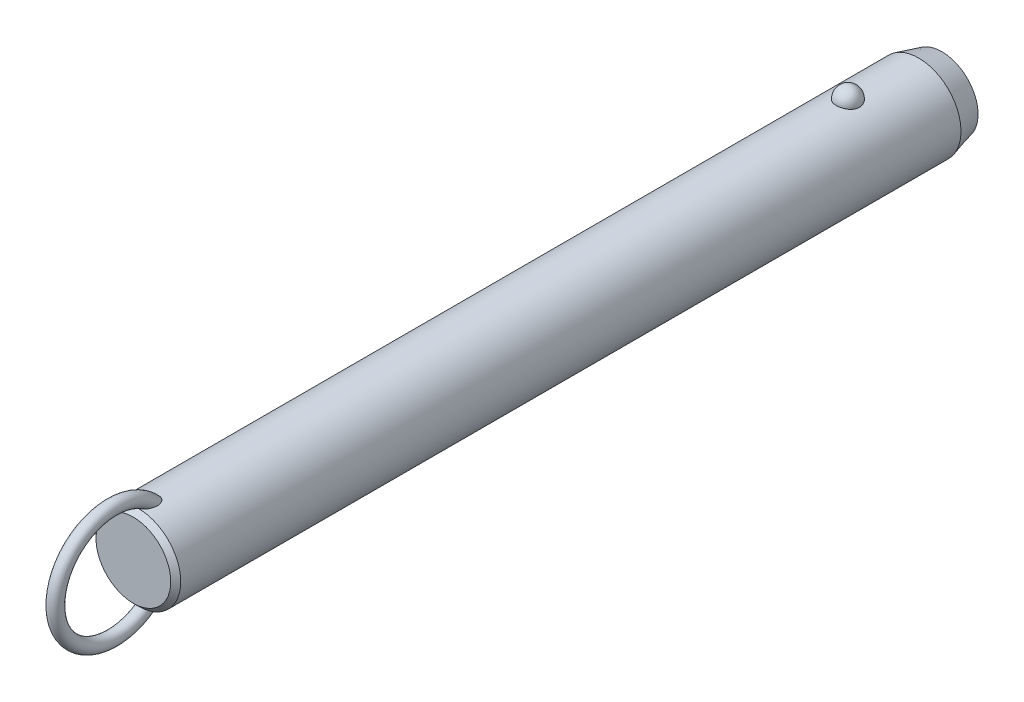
SolidWorks part; units mm, degrees
ref_plane "Front Plane" through (0, 0, 0) normal (0, 0, 1) x (1, 0, 0)
ref_plane "Top Plane" through (0, 0, 0) normal (0, 1, 0) x (1, 0, 0)
ref_plane "Right Plane" through (0, 0, 0) normal (1, 0, 0) x (0, 0, -1)
sketch "Sketch2" plane through (0, 0, 0) normal (0, 0, 1) x (1, 0, 0)
  circle A0 centre (0, 0) radius 12.7
  point P3 (0, 12.7)
  dimension "D1" = 25.4
extrude "Boss-Extrude1" add sketch "Sketch2" along normal blind 198.1
sketch "Sketch3" plane through (0, 0, 0) normal (0, 0, -1) x (-1, 0, 0)
  circle A0 centre (0, 0) radius 12.7
  dimension "D1" = 25.4
extrude "Boss-Extrude2" add sketch "Sketch3" along normal blind 31.7
chamfer "Chamfer1" distance 7 angle 15 1 edges at (-12.7, 0, -31.7)
sketch "Sketch12" plane through (0, 0, 0) normal (1, 0, 0) x (0, 0, -1)
  line L0 (-198.1, 12.7) -> (-198.1, -12.7) construction
  point P0 (-198.1, 0)
sketch "Sketch13" plane through (0, 0, 0) normal (1, 0, 0) x (0, 0, -1)
  circle A0 centre (-217.15, 0) radius 19.05
  point P2 (-198.1, 0)
  dimension "D1" = 38.1
sketch "Sketch14" plane through (0, 0, 0) normal (0, 1, 0) x (1, 0, 0)
  circle A0 centre (0, -200.1) radius 2
  point P2 (0, -198.1)
  dimension "D1" = 4
sweep "Sweep1" add profiles "Sketch14" path "Sketch13"
sketch "Sketch15" plane through (0, 0, 198.1) normal (0, 0, 1) x (1, 0, 0)
  circle A0 centre (0, 0) radius 12.7
  dimension "D1" = 25.4
extrude "Boss-Extrude3" add sketch "Sketch15" along normal blind 12.7
chamfer "Chamfer2" distance 1.5 angle 45 1 edges at (12.7, 0, 210.8)
sketch "Sketch18" plane through (0, 0, 0) normal (1, 0, 0) x (0, 0, -1)
  line L0 (24.7, 12.7) -> (-202.951, 12.7) construction
  line L1 (3.5, 16.2) -> (3.5, 9.2)
  line L2 (-202.951, -12.7) -> (24.7, -12.7) construction
  arc A0 (3.5, 16.2) -> (3.5, 9.2) centre (3.5, 12.7) ccw
  point P4 (0, 12.7)
  dimension "D1" = 28.9
revolve "Revolve1" add sketch "Sketch18" angle 360 about L1
